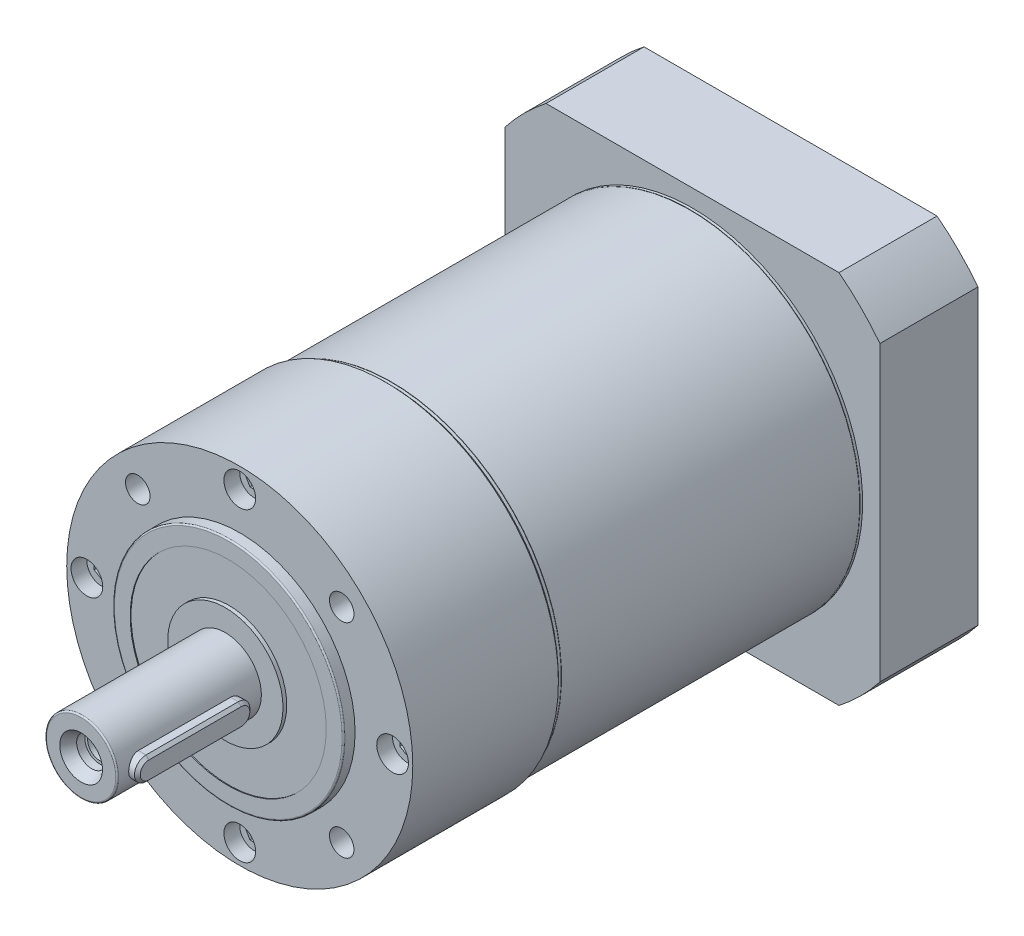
SolidWorks part; units mm, degrees
ref_plane "前视基准面" through (0, 0, 0) normal (0, 0, 1) x (1, 0, 0)
ref_plane "上视基准面" through (0, 0, 0) normal (0, 1, 0) x (1, 0, 0)
ref_plane "右视基准面" through (0, 0, 0) normal (1, 0, 0) x (0, 0, -1)
sketch "草图1" plane through (0, 0, 0) normal (0, 0, 1) x (1, 0, 0)
  circle A0 centre (0, 0) radius 60
extrude "凸台-拉伸1" add sketch "草图1" along normal blind 56.5
sketch "草图2" plane through (0, 0, 56.5) normal (0, 0, 1) x (1, 0, 0)
  circle A0 centre (0, 0) radius 40
extrude "切除-拉伸1" cut sketch "草图2" against normal blind 4 flip side to cut
sketch "草图3" plane through (0, 0, 0) normal (0, 0, -1) x (-1, 0, 0)
  circle A0 centre (0, 0) radius 59
extrude "切除-拉伸2" cut sketch "草图3" against normal blind 1 flip side to cut
chamfer "倒角1" distance 1 angle 45 1 edges at (-60, 0, 1)
ref_plane "基准面1" through (0, 0, -0.1) normal (0, 0, -1) x (-1, 0, 0)
sketch "草图4" plane through (0, 0, -0.1) normal (0, 0, -1) x (-1, 0, 0)
  circle A0 centre (0, 0) radius 59
extrude "凸台-拉伸2" add sketch "草图4" along normal blind 103.4 separate body
ref_plane "基准面2" through (0, 0, -103.6) normal (0, 0, -1) x (-1, 0, 0)
sketch "草图5" plane through (0, 0, -103.6) normal (0, 0, -1) x (-1, 0, 0)
  circle A0 centre (0, 0) radius 59
extrude "凸台-拉伸3" add sketch "草图5" along normal blind 0.9 separate body
sketch "草图6" plane through (0, 0, -104.5) normal (0, 0, -1) x (-1, 0, 0)
  line L1 (-50.806, 65) -> (50.806, 65)
  line L2 (-65, 50.806) -> (-65, -50.806)
  line L3 (-50.806, -65) -> (50.806, -65)
  line L4 (65, 50.806) -> (65, -50.806)
  arc A0 (-50.806, 65) -> (-65, 50.806) centre (0, 0) ccw
  arc A1 (-65, -50.806) -> (-50.806, -65) centre (0, 0) ccw
  arc A2 (50.806, -65) -> (65, -50.806) centre (0, 0) ccw
  arc A3 (65, 50.806) -> (50.806, 65) centre (0, 0) ccw
  dimension "D1" = 65
  dimension "D3" = 65
extrude "凸台-拉伸4" add sketch "草图6" along normal blind 34
sketch "草图7" plane through (0, 0, -138.5) normal (0, 0, -1) x (-1, 0, 0)
  circle A0 centre (0, 0) radius 55
extrude "切除-拉伸3" cut sketch "草图7" against normal blind 8
sketch "草图8" plane through (0, 0, -130.5) normal (0, 0, -1) x (-1, 0, 0)
  circle A0 centre (0, 0) radius 39
extrude "切除-拉伸4" cut sketch "草图8" against normal blind 30
sketch "草图9" plane through (0, 0, -138.5) normal (0, 0, -1) x (-1, 0, 0)
  line L0 (0, 0) -> (-53.5, 0) construction
  circle A0 centre (0, 0) radius 53.5 construction
  circle A1 centre (-53.5, 0) radius 5.5
extrude "切除-拉伸5" cut sketch "草图9" against normal blind 18
pattern_circular "阵列(圆周)1" count 6 over 360 about axis through (0, 0, 0) along (0, 0, 1) of "切除-拉伸5"
sketch "草图10" plane through (0, 0, -138.5) normal (0, 0, -1) x (-1, 0, 0)
  line L0 (0, 0) -> (-51.2652, 51.2652)
  circle A0 centre (0, 0) radius 72.5
hole_wizard "M8 螺纹孔1" positions "3D草图1" profile "草图11" tap size "M8" standard "GB"
sketch3d "3D草图1"
  point P0 (51.2652, 51.2652, -138.5)
sketch "草图11" plane through (51.2652, 51.2652, -138.5) normal (1, 0, 0) x (0, 1, 0)
  line L0 (0, 0) -> (0, 32.0429)
  line L1 (0, 32.0429) -> (3.4, 30)
  line L2 (3.4, 30) -> (3.4, 0)
  line L5 (3.4, 0) -> (0, 0)
  line L10 (0, 32.0429) -> (-3.4, 30) construction
  line L11 (0, -6.35) -> (0, 107.95) construction
  dimension "螺纹孔钻头直径" = 6.8
  dimension "螺纹孔钻头深度" = 30
  dimension "导头角度" = 118
pattern_circular "阵列(圆周)2" count 4 over 360 about axis through (0, 0, 0) along (0, 0, 1) of "M8 螺纹孔1"
fillet "圆角1" radius 0.5 1 edges at (40, 0, 56.5)
sketch "草图12" plane through (0, 0, 56.5) normal (0, 0, 1) x (1, 0, 0)
  circle A0 centre (0, 0) radius 20
extrude "凸台-拉伸5" add sketch "草图12" along normal blind 1
sketch "草图13" plane through (0, 0, 57.5) normal (0, 0, 1) x (1, 0, 0)
  circle A0 centre (0, 0) radius 12.5
extrude "凸台-拉伸6" add sketch "草图13" along normal blind 50
fillet "圆角2" radius 0.5 1 edges at (12.5, 0, 107.5)
sketch "草图14" plane through (0, 0, 52.5) normal (0, 0, 1) x (1, 0, 0)
  line L0 (0, 0) -> (0, -53) construction
  circle A0 centre (0, 0) radius 53 construction
  circle A1 centre (0, -53) radius 5.5
extrude "切除-拉伸6" cut sketch "草图14" against normal blind 11
pattern_circular "阵列(圆周)3" count 4 over 360 about axis through (0, 0, 0) along (0, 0, 1) of "切除-拉伸6"
sketch "草图15" plane through (0, 0, 41.5) normal (0, 0, 1) x (1, 0, 0)
  line L1 (1.4595, -50.5094) -> (-1.4271, -50.4907)
  line L2 (-1.4271, -50.4907) -> (-2.8867, -52.9813)
  line L3 (-2.8867, -52.9813) -> (-1.4595, -55.4906)
  line L4 (-1.4595, -55.4906) -> (1.4271, -55.5093)
  line L5 (1.4271, -55.5093) -> (2.8867, -53.0187)
  line L6 (2.8867, -53.0187) -> (1.4595, -50.5094)
  circle A0 centre (0, -53) radius 5
  circle A1 centre (0, -53) radius 2.5 construction
  dimension "D1" = 5
extrude "凸台-拉伸7" add sketch "草图15" along normal blind 6
pattern_circular "阵列(圆周)4" count 4 over 360 about axis through (0, 0, 0) along (0, 0, 1) of "凸台-拉伸7"
sketch "草图16" plane through (0, 0, -120.5) normal (0, 0, -1) x (-1, 0, 0)
  line L1 (-51.8653, 2.3793) -> (-54.7432, 2.6053)
  line L2 (-54.7432, 2.6053) -> (-56.3779, 0.226)
  line L3 (-56.3779, 0.226) -> (-55.1347, -2.3793)
  line L4 (-55.1347, -2.3793) -> (-52.2568, -2.6053)
  line L5 (-52.2568, -2.6053) -> (-50.6221, -0.226)
  line L6 (-50.6221, -0.226) -> (-51.8653, 2.3793)
  circle A0 centre (-53.5, 0) radius 5
  circle A1 centre (-53.5, 0) radius 2.5 construction
  dimension "D1" = 5
extrude "凸台-拉伸8" add sketch "草图16" along normal blind 6
pattern_circular "阵列(圆周)5" count 6 over 360 about axis through (0, 0, 0) along (0, 0, 1) of "凸台-拉伸8"
ref_plane "基准面3" through (0, 0, -123.5) normal (0, 0, -1) x (-1, 0, 0)
sketch "草图17" plane through (0, 0, -123.5) normal (0, 0, -1) x (-1, 0, 0)
  circle A0 centre (0, 0) radius 32.5
extrude "凸台-拉伸9" add sketch "草图17" against normal up to surface (23 mm away)
chamfer "倒角2" distance 1 angle 45 1 edges at (-32.5, 0, -123.5)
sketch "草图18" plane through (0, 0, -123.5) normal (0, 0, -1) x (-1, 0, 0)
  line L1 (-35.6857, 0.5) -> (35.4718, 0.5)
  line L2 (-35.6857, 0.5) -> (-35.6857, -0.5)
  line L3 (-35.6857, -0.5) -> (35.4718, -0.5)
  line L4 (35.4718, 0.5) -> (35.4718, -0.5)
  dimension "D1" = 0.5
  dimension "D2" = 1
extrude "切除-拉伸7" cut sketch "草图18" against normal up to surface (23 mm away)
sketch "草图19" plane through (0, 0, -138.5) normal (0, 0, -1) x (-1, 0, 0)
  circle A0 centre (0, 0) radius 11
extrude "切除-拉伸8" cut sketch "草图19" against normal blind 59
sketch "草图20" plane through (0, 0, 52.5) normal (0, 0, 1) x (1, 0, 0)
  line L0 (0, 0) -> (-35.3553, 35.3553)
  line L1 (0, 0) -> (0, 53)
  circle A0 centre (0, 0) radius 50
  dimension "D1" = 45
hole_wizard "M10 螺纹孔1" positions "3D草图2" profile "草图21" tap size "M10" standard "GB"
sketch3d "3D草图2"
  point P0 (-35.3553, 35.3553, 52.5)
sketch "草图21" plane through (-35.3553, 35.3553, 52.5) normal (1, 0, 0) x (0, -1, 0)
  line L0 (0, 0) -> (0, 30.0537)
  line L1 (0, 30.0537) -> (4.25, 27.5)
  line L2 (4.25, 27.5) -> (4.25, 0)
  line L5 (4.25, 0) -> (0, 0)
  line L10 (0, 30.0537) -> (-4.25, 27.5) construction
  line L11 (0, -6.35) -> (0, 107.95) construction
  dimension "螺纹孔钻头直径" = 8.5
  dimension "螺纹孔钻头深度" = 27.5
  dimension "导头角度" = 118
pattern_circular "阵列(圆周)6" count 4 over 360 about axis through (0, 0, 0) along (0, 0, 1) of "M10 螺纹孔1"
sketch "草图22" plane through (0, 0, 0) normal (1, 0, 0) x (0, 0, -1)
  line L0 (-107.5, 12) -> (-107.5, -12) construction
  line L1 (-99.5, 4) -> (-67.5, 4)
  line L2 (-99.5, -4) -> (-67.5, -4)
  arc A0 (-99.5, 4) -> (-99.5, -4) centre (-99.5, 0) ccw
  arc A1 (-67.5, -4) -> (-67.5, 4) centre (-67.5, 0) ccw
  dimension "D1" = 8
  dimension "D2" = 32
extrude "凸台-拉伸10" add sketch "草图22" along normal blind 15.5
chamfer "倒角3" distance 1 angle 45 4 edges at (15.5, 4, 83.5) (15.5, 0, 103.5) (15.5, 0, 63.5) (15.5, -4, 83.5)
sketch "草图23" plane through (0, 0, 107.5) normal (0, 0, 1) x (1, 0, 0)
  circle A0 centre (0, 0) radius 7.4
sketch "草图24" plane through (0, 0, 107.5) normal (0, 0, 1) x (1, 0, 0)
  circle A0 centre (0, 0) radius 5.25
extrude "切除-拉伸9" cut sketch "草图24" against normal blind 6.5
ref_plane "基准面4" through (0, 0, 103.8) normal (0, 0, 1) x (1, 0, 0)
sketch "草图25" plane through (0, 0, 103.8) normal (0, 0, 1) x (1, 0, 0)
  circle A0 centre (0, 0) radius 5.25 construction
  circle A1 centre (0, 0) radius 5.25
loft "切除-放样1" cut profiles "草图25", "草图23"
hole_wizard "M10 螺纹孔2" positions "3D草图3" profile "草图26" tap size "M10" standard "GB"
sketch3d "3D草图3"
  line L0 (0, 0, 101) -> (0, 0, 103.8) construction
  point P0 (0, 0, 101)
sketch "草图26" plane through (0, 0, 101) normal (1, 0, 0) x (0, -1, 0)
  line L0 (0, 0) -> (0, 26.5537)
  line L1 (0, 26.5537) -> (4.25, 24)
  line L2 (4.25, 24) -> (4.25, 0)
  line L5 (4.25, 0) -> (0, 0)
  line L10 (0, 26.5537) -> (-4.25, 24) construction
  line L11 (0, -6.35) -> (0, 107.95) construction
  dimension "螺纹孔钻头直径" = 8.5
  dimension "螺纹孔钻头深度" = 24
  dimension "导头角度" = 118
sketch "草图27" plane through (0, 0, 56.5) normal (0, 0, 1) x (1, 0, 0)
  circle A0 centre (0, 0) radius 34
  circle A1 centre (0, 0) radius 20
extrude "切除-拉伸10" cut sketch "草图27" against normal blind 0.3
